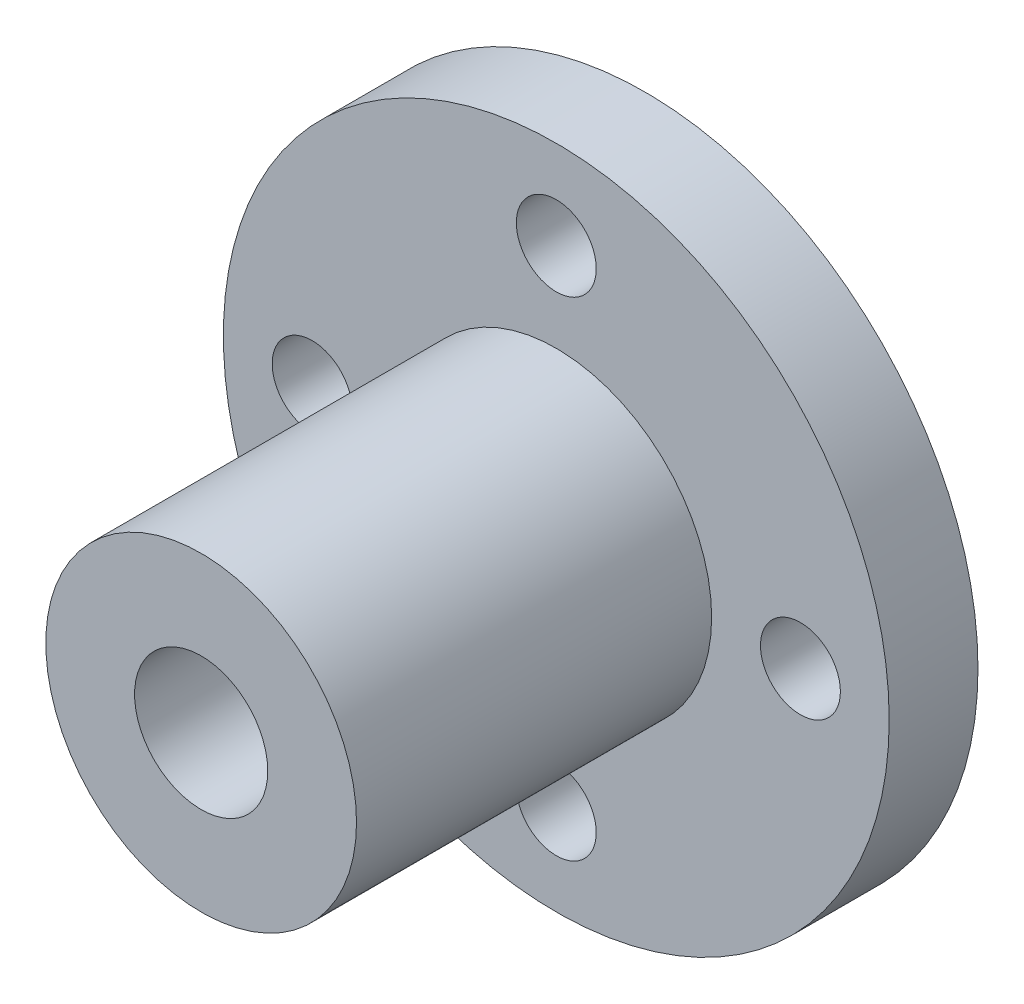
SolidWorks part; units mm, degrees
ref_plane "Front Plane" through (0, 0, 0) normal (0, 0, 1) x (1, 0, 0)
ref_plane "Top Plane" through (0, 0, 0) normal (0, 1, 0) x (1, 0, 0)
ref_plane "Right Plane" through (0, 0, 0) normal (1, 0, 0) x (0, 0, -1)
sketch "Sketch1" plane through (0, 0, 0) normal (1, 0, 0) x (0, 0, -1)
  line L0 (0, 0) -> (83.1362, 0) construction
  line L1 (50, 7.5) -> (0, 7.5)
  line L2 (0, 7.5) -> (0, 17.5)
  line L3 (0, 17.5) -> (40, 17.5)
  line L4 (40, 17.5) -> (40, 37.5)
  line L5 (40, 37.5) -> (50, 37.5)
  line L6 (50, 37.5) -> (50, 7.5)
  dimension "D1" = 10
  dimension "D2" = 15
  dimension "D3" = 10
  dimension "D4" = 50
  dimension "D5" = 30
revolve "Revolve1" add sketch "Sketch1" angle 360 about L0
hole_wizard "M10x1.0 Tapped Hole1" positions "Sketch3" profile "Sketch2" tap size "M10x1.0" standard "Ansi Metric"
sketch "Sketch3" plane through (0, 0, -40) normal (0, 0, 1) x (1, 0, 0)
  line L0 (0, 37.5) -> (0, 17.5) construction
  circle A0 centre (0, 0) radius 37.5 construction
  circle A1 centre (0, 0) radius 17.5 construction
  point P0 (0, 27.5)
sketch "Sketch2" plane through (0, 27.5, -40) normal (1, 0, 0) x (0, -1, 0)
  line L0 (0, 0) -> (0, 25.7039)
  line L1 (0, 25.7039) -> (4.5, 23)
  line L2 (4.5, 23) -> (4.5, 0)
  line L5 (4.5, 0) -> (0, 0)
  line L10 (0, 25.7039) -> (-4.5, 23) construction
  line L11 (0, -6.35) -> (0, 107.95) construction
  dimension "Tap Drill Dia." = 9
  dimension "Tap Drill Depth" = 23
  dimension "Drill Angle" = 118
pattern_circular "CirPattern1" count 4 over 360 about axis through (0, 0, 0) along (0, 0, 1) of "M10x1.0 Tapped Hole1"
